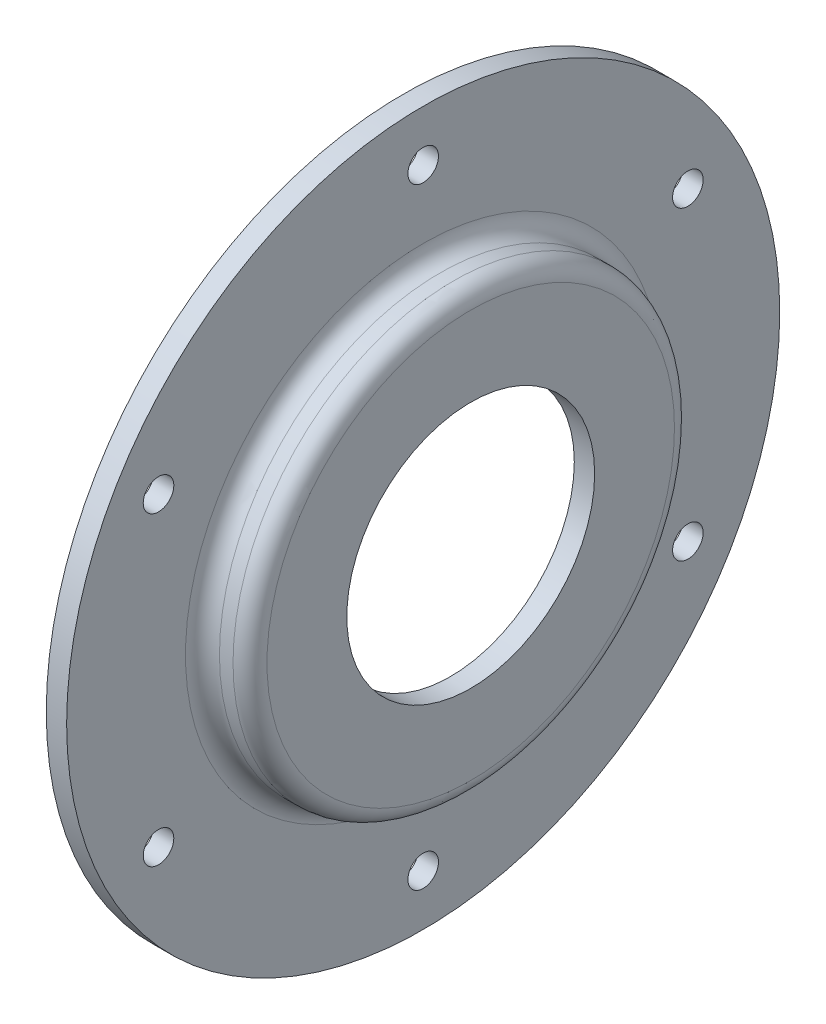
SolidWorks part; units mm, degrees
ref_plane "Front Plane" through (0, 0, 0) normal (0, 0, 1) x (1, 0, 0)
ref_plane "Top Plane" through (0, 0, 0) normal (0, 1, 0) x (1, 0, 0)
ref_plane "Right Plane" through (0, 0, 0) normal (1, 0, 0) x (0, 0, -1)
sketch "Sketch1" plane through (0, 0, 0) normal (0, 0, 1) x (1, 0, 0)
  line L0 (0, 59) -> (0, 36.5)
  line L1 (-8, 105) -> (-8, 70)
  line L2 (-3, 65) -> (1, 65)
  line L3 (6, 60) -> (6, 36.5)
  line L4 (-14, 105) -> (-8, 105)
  line L5 (0, 0) -> (-65, 0) construction
  line L6 (-14, 59) -> (0, 59)
  line L7 (-14, 105) -> (-14, 59)
  line L8 (0, 36.5) -> (6, 36.5)
  line L9 (-8, 105) -> (-8, 65) construction
  line L10 (-8, 65) -> (6, 65) construction
  line L11 (6, 65) -> (6, 36.5) construction
  arc A0 (-8, 70) -> (-3, 65) centre (-3, 70) ccw
  arc A1 (1, 65) -> (6, 60) centre (1, 60) cw
  dimension "D4" = 36.5
  dimension "D6" = 5
  dimension "D1" = 14
  dimension "D2" = 59
  dimension "D3" = 105
  dimension "D5" = 6
revolve "Revolve1" add sketch "Sketch1" angle 360 about L5
sketch "Sketch2" plane through (-8, 0, 0) normal (1, 0, 0) x (0, 0, -1)
  line L0 (0, 90) -> (0, 0) construction
  circle A0 centre (0, 90) radius 4.5
  dimension "D1" = 90
  dimension "D2" = 9
extrude "Cut-Extrude1" cut sketch "Sketch2" against normal through all
pattern_circular "CirPattern1" count 6 over 360 about axis through (0, 0, 0) along (1, 0, 0) of "Cut-Extrude1"
